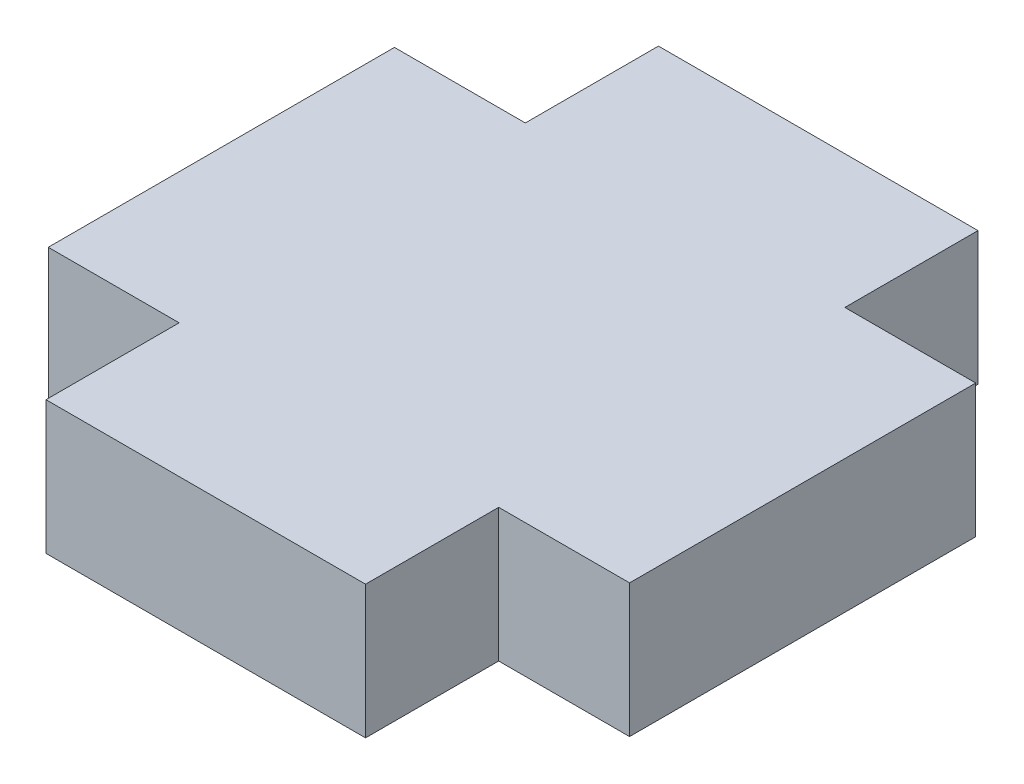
SolidWorks part; units mm, degrees
ref_plane "Front Plane" through (0, 0, 0) normal (0, 0, 1) x (1, 0, 0)
ref_plane "Top Plane" through (0, 0, 0) normal (0, 1, 0) x (1, 0, 0)
ref_plane "Right Plane" through (0, 0, 0) normal (1, 0, 0) x (0, 0, -1)
sketch "Sketch1" plane through (0, 0, 0) normal (0, 1, 0) x (1, 0, 0)
  line L0 (-6, -6.5) -> (-6, -11.5)
  line L2 (-10.915, 6.5) -> (-10.915, -6.5)
  line L3 (-10.915, -6.5) -> (-6, -6.5)
  line L4 (10.915, 6.5) -> (10.915, -6.5)
  line L5 (-6, -11.5) -> (6, -11.5)
  line L6 (6, -11.5) -> (6, -6.5)
  line L7 (-19.422, 0) -> (47.0198, 0) construction
  line L8 (6, -6.5) -> (10.915, -6.5)
  line L9 (6, 11.5) -> (6, 6.5)
  line L10 (-6, 11.5) -> (6, 11.5)
  line L11 (-6, 6.5) -> (-6, 11.5)
  line L12 (-10.915, 6.5) -> (-6, 6.5)
  line L13 (6, 6.5) -> (10.915, 6.5)
  dimension "D1" = 21.83
  dimension "D2" = 10.915
  dimension "D3" = 13
  dimension "D4" = 5
  dimension "D5" = 12
  dimension "D6" = 6
extrude "Boss-Extrude1" add sketch "Sketch1" along normal blind 5
